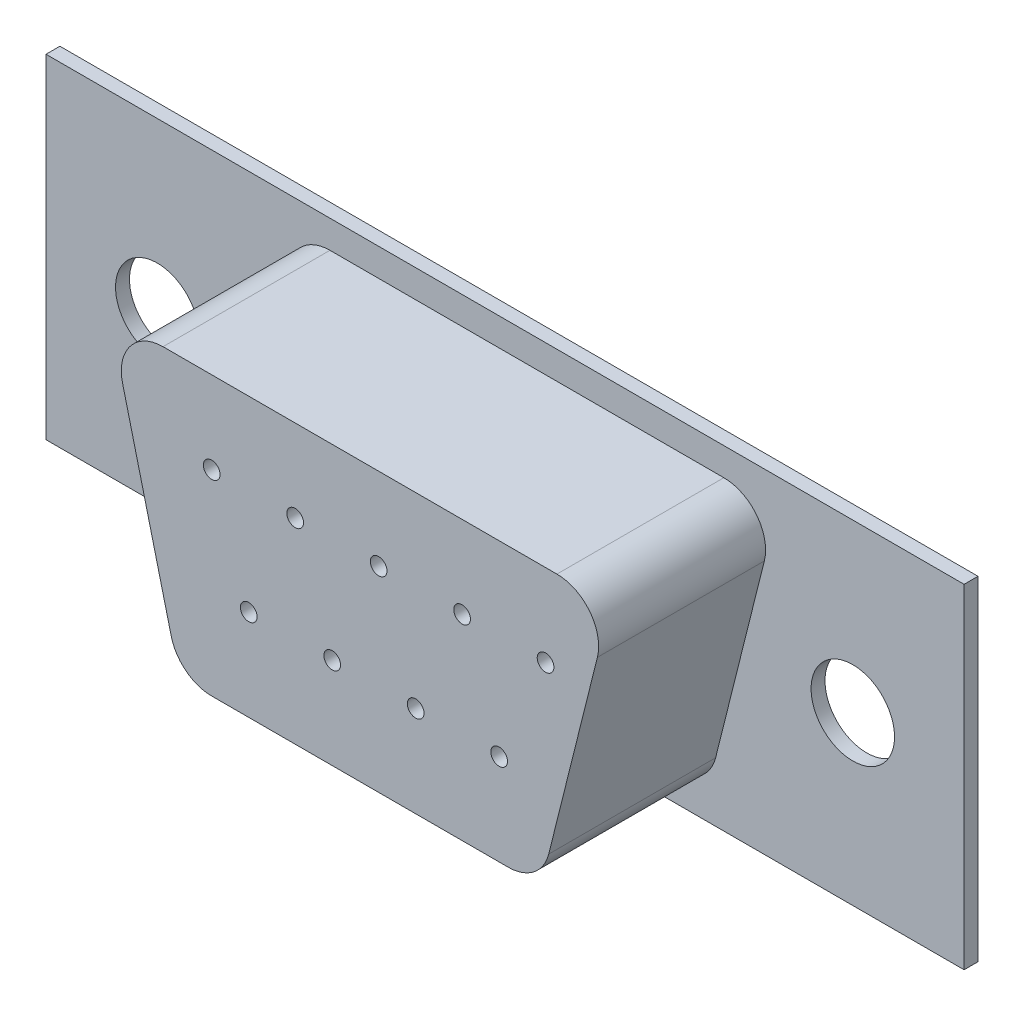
SolidWorks part; units mm, degrees
ref_plane "Face" through (0, 0, 0) normal (0, 0, 1) x (1, 0, 0)
ref_plane "Dessus" through (0, 0, 0) normal (0, 1, 0) x (1, 0, 0)
ref_plane "Droite" through (0, 0, 0) normal (1, 0, 0) x (0, 0, -1)
sketch "Esquisse1" plane through (0, 0, 0) normal (0, 0, 1) x (1, 0, 0)
  line L1 (-16.5, -6) -> (16.5, -6)
  line L2 (-16.5, -6) -> (-16.5, 6)
  line L3 (-16.5, 6) -> (16.5, 6)
  line L4 (16.5, -6) -> (16.5, 6)
  line L5 (-16.5, -6) -> (16.5, 6) construction
  line L6 (-16.5, 6) -> (16.5, -6) construction
  circle A0 centre (-12.5, 0) radius 1.5
  circle A1 centre (12.5, 0) radius 1.5
  point P0 (0, 0)
  dimension "D3" = 3
  dimension "D4" = 3
  dimension "D5" = 25
  dimension "D1" = 12
  dimension "D2" = 33
  dimension "D6" = 4
extrude "Extrusion1" add sketch "Esquisse1" along normal blind 0.5
sketch "Esquisse2" plane through (0, 0, 0.5) normal (0, 0, 1) x (1, 0, 0)
  line L0 (-8.2144, 5) -> (9.7856, 5)
  line L1 (9.7856, 5) -> (7.2856, -5)
  line L2 (7.2856, -5) -> (-5.7144, -5)
  line L3 (-5.7144, -5) -> (-8.2144, 5)
  line L4 (16.5, 6) -> (-16.5, 6) construction
  dimension "D1" = 18
  dimension "D2" = 13
  dimension "D3" = 2.5
  dimension "D4" = 10
  dimension "D5" = 1
extrude "Extrusion2" add sketch "Esquisse2" along normal blind 6
fillet "Congé4" radius 1.5 4 edges at (9.7856, 5, 3.5) (7.2856, -5, 3.5) (-5.7144, -5, 3.5) (-8.2144, 5, 3.5)
sketch "Esquisse3" plane through (0, 0, 0.5) normal (0, 0, 1) x (1, 0, 0)
  circle A0 centre (-4.5431, 2.0421) radius 0.3
  circle A1 centre (-1.5431, 2.0421) radius 0.3
  circle A2 centre (1.4569, 2.0421) radius 0.3
  circle A3 centre (4.4569, 2.0421) radius 0.3
  circle A4 centre (7.4569, 2.0421) radius 0.3
  circle A5 centre (-3.2123, -1.7209) radius 0.3
  circle A6 centre (-0.2123, -1.7209) radius 0.3
  circle A7 centre (2.7877, -1.7209) radius 0.3
  circle A8 centre (5.7877, -1.7209) radius 0.3
  dimension "D1" = 0.6
  dimension "D2" = 0.6
extrude "Extrusion3" cut sketch "Esquisse3" along normal through all
